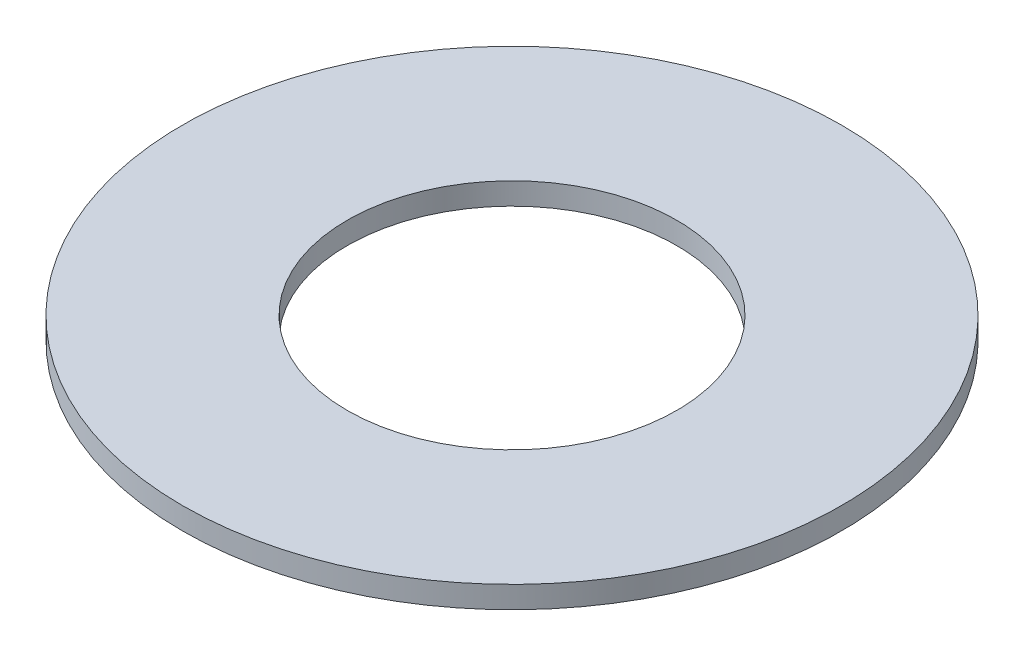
SolidWorks part; units mm, degrees
ref_plane "Ebene vorne" through (0, 0, 0) normal (0, 0, 1) x (1, 0, 0)
ref_plane "Ebene oben" through (0, 0, 0) normal (0, 1, 0) x (1, 0, 0)
ref_plane "Ebene rechts" through (0, 0, 0) normal (1, 0, 0) x (0, 0, -1)
sketch "Skizze2" plane through (0, 0, 0) normal (0, 1, 0) x (1, 0, 0)
  circle A0 centre (0, 0) radius 3
  circle A1 centre (0, 0) radius 1.5
  dimension "D1" = 6
  dimension "D2" = 3
extrude "Aufsatz-Linear austragen1" add sketch "Skizze2" along normal blind 0.2
